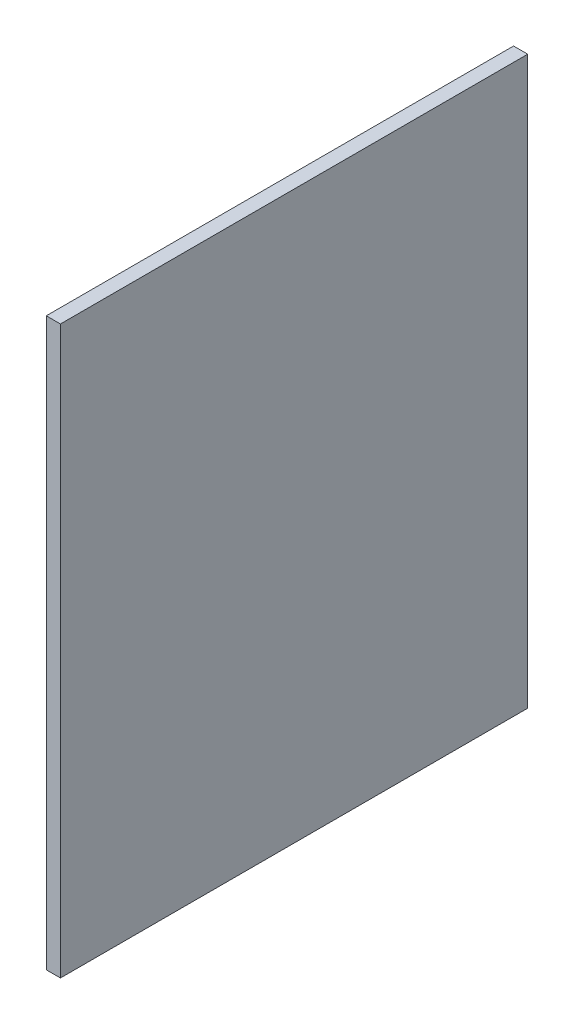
SolidWorks part; units mm, degrees
ref_plane "Front" through (0, 0, 0) normal (0, 0, 1) x (1, 0, 0)
ref_plane "Top" through (0, 0, 0) normal (0, 1, 0) x (1, 0, 0)
ref_plane "Right" through (0, 0, 0) normal (1, 0, 0) x (0, 0, -1)
sketch "Sketch1" plane through (0, 0, 0) normal (1, 0, 0) x (0, 0, -1)
  line L0 (0, 101.3576) -> (0, -102.0169) construction
  line L1 (-247.65, 254) -> (171.45, 254)
  line L2 (-247.65, 254) -> (-247.65, -254)
  line L3 (-247.65, -254) -> (171.45, -254)
  line L4 (171.45, 254) -> (171.45, -254)
  line L5 (-121.9588, 0) -> (118.333, 0) construction
  dimension "D1" = 419.1
  dimension "D2" = 254
  dimension "D3" = 508
extrude "Extrude1" add sketch "Sketch1" along normal blind 12.7
